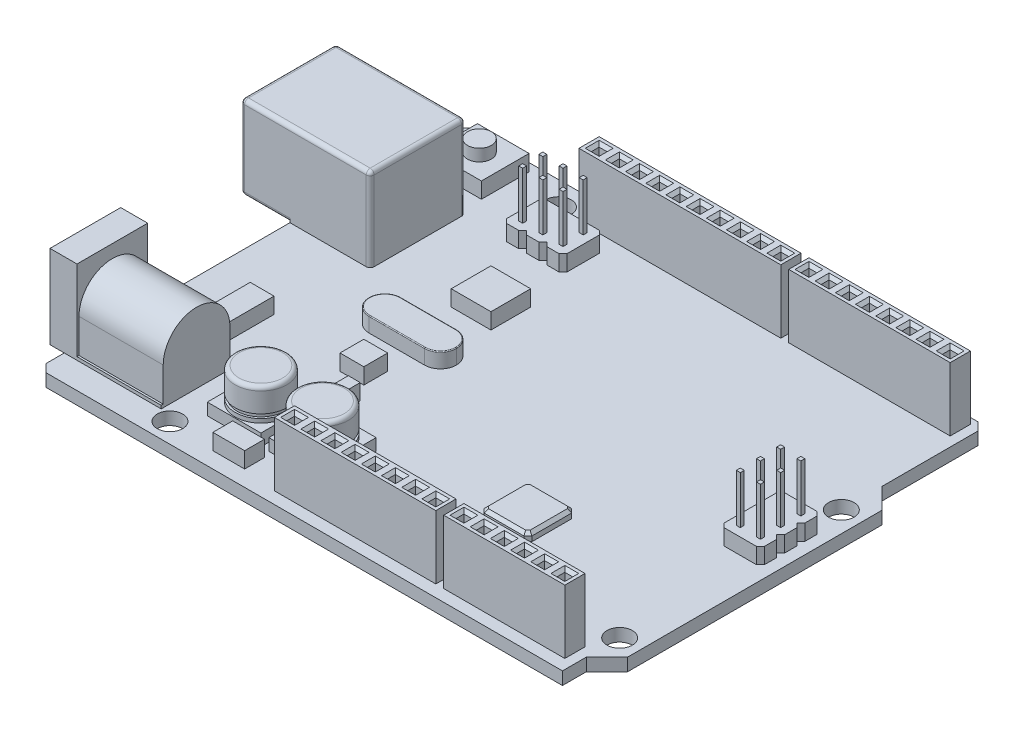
SolidWorks part; units mm, degrees
ref_plane "Front Plane" through (0, 0, 0) normal (0, 0, 1) x (1, 0, 0)
ref_plane "Top Plane" through (0, 0, 0) normal (0, 1, 0) x (1, 0, 0)
ref_plane "Right Plane" through (0, 0, 0) normal (1, 0, 0) x (0, 0, -1)
ref_plane "Decoupe" through (0, 4.1, 0) normal (0, 1, 0) x (-1, 0, 0)
sketch "Sketch1" plane through (0, 0, 0) normal (0, 1, 0) x (1, 0, 0)
  line L0 (35.6, 10.95) -> (35.6, -21.05)
  line L1 (33, -26.65) -> (-32, -26.65)
  line L2 (33, -26.65) -> (33, -23.65)
  line L3 (32, 26.65) -> (-32, 26.65)
  line L4 (-33, -25.65) -> (-33, 25.65)
  line L5 (33, -26.65) -> (-33, 26.65) construction
  line L6 (33, 26.65) -> (-33, -26.65) construction
  line L7 (35.6, -21.05) -> (33, -23.65)
  line L8 (35.6, 10.95) -> (33, 13.55)
  line L9 (33, 13.55) -> (33, 25.65)
  line L10 (-32, -26.65) -> (-33, -25.65)
  line L11 (-33, 25.65) -> (-32, 26.65)
  line L12 (33, 25.65) -> (32, 26.65)
  circle A0 centre (-17.8, 23.65) radius 1.6
  circle A1 centre (-18.9, -24.15) radius 1.6
  circle A2 centre (33, -19.45) radius 1.6
  circle A3 centre (33, 8.45) radius 1.6
  point P0 (0, 0)
  dimension "D7" = 3.2
  dimension "D1" = 66
  dimension "D2" = 53.3
  dimension "D3" = 68.6
  dimension "D4" = 32
  dimension "D5" = 45
  dimension "D6" = 3
  dimension "D8" = 2.5
  dimension "D9" = 27.9
  dimension "D10" = 4.7
  dimension "D11" = 50.8
  dimension "D12" = 51.9
  dimension "D17" = 1.1
  dimension "D18" = 15.2
extrude "Boss-Extrude1" add sketch "Sketch1" along normal blind 1.6
sketch "Sketch2" plane through (0, 1.6, 0) normal (0, 1, 0) x (1, 0, 0)
  line L0 (-33, 25.65) -> (-33, -25.65) construction
  line L1 (-39.2, 17.05) -> (-22.9, 17.05)
  line L2 (-39.2, 17.05) -> (-39.2, 5.05)
  line L3 (-39.2, 5.05) -> (-22.9, 5.05)
  line L4 (-22.9, 17.05) -> (-22.9, 5.05)
  line L5 (32, 26.65) -> (-32, 26.65) construction
  line L6 (-32, -26.65) -> (33, -26.65) construction
  line L7 (-34.8, -14.45) -> (-20.8, -14.45)
  line L8 (-34.8, -14.45) -> (-34.8, -23.35)
  line L9 (-34.8, -23.35) -> (-20.8, -23.35)
  line L10 (-20.8, -14.45) -> (-20.8, -23.35)
  dimension "D1" = 16.3
  dimension "D2" = 12
  dimension "D3" = 6.2
  dimension "D4" = 9.6
  dimension "D5" = 8.9
  dimension "D6" = 14
  dimension "D7" = 1.8
  dimension "D8" = 3.3
extrude "Boss-Extrude2" add sketch "Sketch2" along normal blind 10.5
sketch "Sketch4" plane through (-39.2, 0, 0) normal (-1, 0, 0) x (0, 0, 1)
  line L0 (-11.05, 12.1) -> (-11.05, 1.6) construction
  line L1 (-17.05, 12.1) -> (-5.05, 12.1) construction
  line L2 (-17.05, 1.6) -> (-5.05, 1.6) construction
  line L3 (-6.55, 3.1) -> (-15.55, 3.1)
  line L4 (-15.55, 3.1) -> (-15.55, 8.1)
  line L5 (-15.55, 8.1) -> (-14.35, 10.6)
  line L6 (-14.35, 10.6) -> (-7.75, 10.6)
  line L7 (-7.75, 8.1) -> (-14.35, 8.1)
  line L8 (-14.35, 8.1) -> (-14.35, 5.6)
  line L9 (-14.35, 5.6) -> (-7.75, 5.6)
  line L10 (-7.75, 8.1) -> (-7.75, 5.6)
  line L11 (-6.55, 8.1) -> (-7.75, 10.6)
  line L12 (-6.55, 3.1) -> (-6.55, 8.1)
  point P16 (-11.05, 5.6)
  point P17 (-11.05, 8.1)
  point P18 (-11.05, 10.6)
  point P20 (-11.05, 3.1)
  dimension "D1" = 2.5
  dimension "D2" = 7.5
  dimension "D3" = 9
  dimension "D4" = 1.5
  dimension "D5" = 2.5
  dimension "D6" = 1.2
  dimension "D7" = 1.2
extrude "Cut-Extrude1" cut sketch "Sketch4" against normal blind 10
sketch "Sketch5" plane through (-34.8, 0, 0) normal (-1, 0, 0) x (0, 0, 1)
  line L0 (18.9, 6.85) -> (14.45, 6.85) construction
  line L1 (14.45, 12.1) -> (14.45, 1.6) construction
  line L2 (18.9, 6.85) -> (18.9, 12.1) construction
  line L3 (14.45, 12.1) -> (23.35, 12.1) construction
  circle A0 centre (18.9, 6.85) radius 3.5
  circle A1 centre (18.9, 6.85) radius 0.5
  dimension "D1" = 7
  dimension "D2" = 1
extrude "Cut-Extrude2" cut sketch "Sketch5" against normal blind 10
sketch "Sketch6" plane through (-20.8, 0, 0) normal (1, 0, 0) x (0, 0, -1)
  line L0 (-18.9, 12.1) -> (-18.9, 1.6) construction
  line L1 (-23.35, 12.1) -> (-14.45, 12.1) construction
  line L2 (-23.35, 1.6) -> (-14.45, 1.6) construction
  line L3 (-23.1, 6.267) -> (-23.1, 2)
  line L4 (-23.35, 12.1) -> (-23.35, 1.6) construction
  line L5 (-23.35, 2) -> (-23.35, 12.1)
  line L6 (-23.35, 12.1) -> (-14.45, 12.1)
  line L7 (-14.45, 2) -> (-14.45, 12.1)
  line L8 (-23.65, 1.6) -> (-21.05, 1.6) construction
  line L9 (-23.1, 2) -> (-23.35, 2)
  line L10 (-14.7, 2) -> (-14.45, 2)
  line L11 (-14.7, 6.267) -> (-14.7, 2)
  arc A0 (-14.7, 6.267) -> (-23.1, 6.267) centre (-18.9, 6.267) ccw
  dimension "D2" = 0.4
  dimension "D1" = 0.25
  dimension "D3" = 4.667
extrude "Cut-Extrude3" cut sketch "Sketch6" against normal offset from surface (10.6 mm away) 3.4
sketch "Sketch7" plane through (0, 1.6, 0) normal (0, 1, 0) x (1, 0, 0)
  line L0 (-14.9202, 24.62) -> (31.7998, 24.62) construction
  line L1 (-14.9202, 25.89) -> (10.4798, 25.89)
  line L2 (-14.9202, 25.89) -> (-14.9202, 23.35)
  line L3 (-14.9202, 23.35) -> (10.4798, 23.35)
  line L4 (10.4798, 25.89) -> (10.4798, 23.35)
  line L5 (11.4798, 25.89) -> (31.7998, 25.89)
  line L6 (11.4798, 25.89) -> (11.4798, 23.35)
  line L7 (11.4798, 23.35) -> (31.7998, 23.35)
  line L8 (31.7998, 25.89) -> (31.7998, 23.35)
  line L9 (27.4898, 24.12) -> (28.4898, 24.12)
  line L10 (30.0298, 24.12) -> (31.0298, 24.12)
  line L11 (30.0298, 24.12) -> (30.0298, 25.12)
  line L12 (30.0298, 25.12) -> (31.0298, 25.12)
  line L13 (31.0298, 24.12) -> (31.0298, 25.12)
  line L14 (30.0298, 24.12) -> (31.0298, 25.12) construction
  line L15 (30.0298, 25.12) -> (31.0298, 24.12) construction
  line L16 (27.4898, 24.12) -> (27.4898, 25.12)
  line L17 (27.4898, 25.12) -> (28.4898, 25.12)
  line L18 (28.4898, 24.12) -> (28.4898, 25.12)
  line L19 (27.4898, 24.12) -> (28.4898, 25.12) construction
  line L20 (27.4898, 25.12) -> (28.4898, 24.12) construction
  line L21 (24.9498, 24.12) -> (25.9498, 24.12)
  line L22 (24.9498, 24.12) -> (24.9498, 25.12)
  line L23 (24.9498, 25.12) -> (25.9498, 25.12)
  line L24 (25.9498, 24.12) -> (25.9498, 25.12)
  line L25 (24.9498, 24.12) -> (25.9498, 25.12) construction
  line L26 (24.9498, 25.12) -> (25.9498, 24.12) construction
  line L27 (22.4098, 24.12) -> (23.4098, 24.12)
  line L28 (22.4098, 24.12) -> (22.4098, 25.12)
  line L29 (22.4098, 25.12) -> (23.4098, 25.12)
  line L30 (23.4098, 24.12) -> (23.4098, 25.12)
  line L31 (22.4098, 24.12) -> (23.4098, 25.12) construction
  line L32 (22.4098, 25.12) -> (23.4098, 24.12) construction
  line L33 (19.8698, 24.12) -> (20.8698, 24.12)
  line L34 (19.8698, 24.12) -> (19.8698, 25.12)
  line L35 (19.8698, 25.12) -> (20.8698, 25.12)
  line L36 (20.8698, 24.12) -> (20.8698, 25.12)
  line L37 (19.8698, 24.12) -> (20.8698, 25.12) construction
  line L38 (19.8698, 25.12) -> (20.8698, 24.12) construction
  line L39 (17.3298, 24.12) -> (18.3298, 24.12)
  line L40 (17.3298, 24.12) -> (17.3298, 25.12)
  line L41 (17.3298, 25.12) -> (18.3298, 25.12)
  line L42 (18.3298, 24.12) -> (18.3298, 25.12)
  line L43 (17.3298, 24.12) -> (18.3298, 25.12) construction
  line L44 (17.3298, 25.12) -> (18.3298, 24.12) construction
  line L45 (14.7898, 24.12) -> (15.7898, 24.12)
  line L46 (14.7898, 24.12) -> (14.7898, 25.12)
  line L47 (14.7898, 25.12) -> (15.7898, 25.12)
  line L48 (15.7898, 24.12) -> (15.7898, 25.12)
  line L49 (14.7898, 24.12) -> (15.7898, 25.12) construction
  line L50 (14.7898, 25.12) -> (15.7898, 24.12) construction
  line L51 (12.2498, 24.12) -> (13.2498, 24.12)
  line L52 (12.2498, 24.12) -> (12.2498, 25.12)
  line L53 (12.2498, 25.12) -> (13.2498, 25.12)
  line L54 (13.2498, 24.12) -> (13.2498, 25.12)
  line L55 (12.2498, 24.12) -> (13.2498, 25.12) construction
  line L56 (12.2498, 25.12) -> (13.2498, 24.12) construction
  line L57 (6.1698, 24.12) -> (7.1698, 24.12)
  line L58 (8.7098, 24.12) -> (9.7098, 24.12)
  line L59 (8.7098, 24.12) -> (8.7098, 25.12)
  line L60 (8.7098, 25.12) -> (9.7098, 25.12)
  line L61 (9.7098, 24.12) -> (9.7098, 25.12)
  line L62 (8.7098, 24.12) -> (9.7098, 25.12) construction
  line L63 (8.7098, 25.12) -> (9.7098, 24.12) construction
  line L64 (6.1698, 24.12) -> (6.1698, 25.12)
  line L65 (6.1698, 25.12) -> (7.1698, 25.12)
  line L66 (7.1698, 24.12) -> (7.1698, 25.12)
  line L67 (6.1698, 24.12) -> (7.1698, 25.12) construction
  line L68 (6.1698, 25.12) -> (7.1698, 24.12) construction
  line L69 (3.6298, 24.12) -> (4.6298, 24.12)
  line L70 (3.6298, 24.12) -> (3.6298, 25.12)
  line L71 (3.6298, 25.12) -> (4.6298, 25.12)
  line L72 (4.6298, 24.12) -> (4.6298, 25.12)
  line L73 (-4.7602, -23.88) -> (31.7998, -23.88) construction
  line L74 (31.7998, -25.15) -> (16.5598, -25.15)
  line L75 (31.7998, -25.15) -> (31.7998, -22.61)
  line L76 (31.7998, -22.61) -> (16.5598, -22.61)
  line L77 (16.5598, -25.15) -> (16.5598, -22.61)
  line L78 (15.5598, -22.61) -> (-4.7602, -22.61)
  line L79 (15.5598, -22.61) -> (15.5598, -25.15)
  line L80 (15.5598, -25.15) -> (-4.7602, -25.15)
  line L81 (-4.7602, -22.61) -> (-4.7602, -25.15)
  line L82 (12.2498, -24.38) -> (11.2498, -24.38)
  line L83 (12.2498, -24.38) -> (12.2498, -23.38)
  line L84 (12.2498, -23.38) -> (11.2498, -23.38)
  line L85 (11.2498, -24.38) -> (11.2498, -23.38)
  line L86 (12.2498, -24.38) -> (11.2498, -23.38) construction
  line L87 (12.2498, -23.38) -> (11.2498, -24.38) construction
  line L88 (9.7098, -24.38) -> (8.7098, -24.38)
  line L89 (18.3298, -24.38) -> (17.3298, -24.38)
  line L90 (18.3298, -24.38) -> (18.3298, -23.38)
  line L91 (18.3298, -23.38) -> (17.3298, -23.38)
  line L92 (17.3298, -24.38) -> (17.3298, -23.38)
  line L93 (18.3298, -24.38) -> (17.3298, -23.38) construction
  line L94 (18.3298, -23.38) -> (17.3298, -24.38) construction
  line L95 (9.7098, -24.38) -> (9.7098, -23.38)
  line L96 (9.7098, -23.38) -> (8.7098, -23.38)
  line L97 (8.7098, -24.38) -> (8.7098, -23.38)
  line L98 (9.7098, -24.38) -> (8.7098, -23.38) construction
  line L99 (9.7098, -23.38) -> (8.7098, -24.38) construction
  line L100 (20.8698, -24.38) -> (19.8698, -24.38)
  line L101 (20.8698, -24.38) -> (20.8698, -23.38)
  line L102 (20.8698, -23.38) -> (19.8698, -23.38)
  line L103 (19.8698, -24.38) -> (19.8698, -23.38)
  line L104 (20.8698, -24.38) -> (19.8698, -23.38) construction
  line L105 (20.8698, -23.38) -> (19.8698, -24.38) construction
  line L106 (7.1698, -24.38) -> (6.1698, -24.38)
  line L107 (7.1698, -24.38) -> (7.1698, -23.38)
  line L108 (7.1698, -23.38) -> (6.1698, -23.38)
  line L109 (6.1698, -24.38) -> (6.1698, -23.38)
  line L110 (7.1698, -24.38) -> (6.1698, -23.38) construction
  line L111 (7.1698, -23.38) -> (6.1698, -24.38) construction
  line L112 (23.4098, -24.38) -> (22.4098, -24.38)
  line L113 (23.4098, -24.38) -> (23.4098, -23.38)
  line L114 (23.4098, -23.38) -> (22.4098, -23.38)
  line L115 (22.4098, -24.38) -> (22.4098, -23.38)
  line L116 (23.4098, -24.38) -> (22.4098, -23.38) construction
  line L117 (23.4098, -23.38) -> (22.4098, -24.38) construction
  line L118 (4.6298, -24.38) -> (3.6298, -24.38)
  line L119 (4.6298, -24.38) -> (4.6298, -23.38)
  line L120 (4.6298, -23.38) -> (3.6298, -23.38)
  line L121 (3.6298, -24.38) -> (3.6298, -23.38)
  line L122 (4.6298, -24.38) -> (3.6298, -23.38) construction
  line L123 (4.6298, -23.38) -> (3.6298, -24.38) construction
  line L124 (25.9498, -24.38) -> (24.9498, -24.38)
  line L125 (25.9498, -24.38) -> (25.9498, -23.38)
  line L126 (25.9498, -23.38) -> (24.9498, -23.38)
  line L127 (24.9498, -24.38) -> (24.9498, -23.38)
  line L128 (25.9498, -24.38) -> (24.9498, -23.38) construction
  line L129 (25.9498, -23.38) -> (24.9498, -24.38) construction
  line L130 (2.0898, -24.38) -> (1.0898, -24.38)
  line L131 (2.0898, -24.38) -> (2.0898, -23.38)
  line L132 (2.0898, -23.38) -> (1.0898, -23.38)
  line L133 (1.0898, -24.38) -> (1.0898, -23.38)
  line L134 (2.0898, -24.38) -> (1.0898, -23.38) construction
  line L135 (2.0898, -23.38) -> (1.0898, -24.38) construction
  line L136 (28.4898, -24.38) -> (27.4898, -24.38)
  line L137 (28.4898, -24.38) -> (28.4898, -23.38)
  line L138 (28.4898, -23.38) -> (27.4898, -23.38)
  line L139 (27.4898, -24.38) -> (27.4898, -23.38)
  line L140 (28.4898, -24.38) -> (27.4898, -23.38) construction
  line L141 (28.4898, -23.38) -> (27.4898, -24.38) construction
  line L142 (14.7898, -24.38) -> (13.7898, -24.38)
  line L143 (14.7898, -24.38) -> (14.7898, -23.38)
  line L144 (14.7898, -23.38) -> (13.7898, -23.38)
  line L145 (13.7898, -24.38) -> (13.7898, -23.38)
  line L146 (14.7898, -24.38) -> (13.7898, -23.38) construction
  line L147 (14.7898, -23.38) -> (13.7898, -24.38) construction
  line L148 (31.0298, -24.38) -> (30.0298, -24.38)
  line L149 (31.0298, -24.38) -> (31.0298, -23.38)
  line L150 (31.0298, -23.38) -> (30.0298, -23.38)
  line L151 (30.0298, -24.38) -> (30.0298, -23.38)
  line L152 (31.0298, -24.38) -> (30.0298, -23.38) construction
  line L153 (31.0298, -23.38) -> (30.0298, -24.38) construction
  line L154 (33, -26.65) -> (33, -23.65) construction
  line L155 (-32, -26.65) -> (33, -26.65) construction
  line L156 (3.6298, 24.12) -> (4.6298, 25.12) construction
  line L157 (-0.4502, -24.38) -> (-1.4502, -24.38)
  line L158 (-0.4502, -24.38) -> (-0.4502, -23.38)
  line L159 (-0.4502, -23.38) -> (-1.4502, -23.38)
  line L160 (-1.4502, -24.38) -> (-1.4502, -23.38)
  line L161 (-0.4502, -24.38) -> (-1.4502, -23.38) construction
  line L162 (-0.4502, -23.38) -> (-1.4502, -24.38) construction
  line L163 (-2.9902, -24.38) -> (-3.9902, -24.38)
  line L164 (-2.9902, -24.38) -> (-2.9902, -23.38)
  line L165 (-2.9902, -23.38) -> (-3.9902, -23.38)
  line L166 (-3.9902, -24.38) -> (-3.9902, -23.38)
  line L167 (-2.9902, -24.38) -> (-3.9902, -23.38) construction
  line L168 (-2.9902, -23.38) -> (-3.9902, -24.38) construction
  line L169 (3.6298, 25.12) -> (4.6298, 24.12) construction
  line L170 (1.0898, 24.12) -> (2.0898, 24.12)
  line L171 (1.0898, 24.12) -> (1.0898, 25.12)
  line L172 (1.0898, 25.12) -> (2.0898, 25.12)
  line L173 (2.0898, 24.12) -> (2.0898, 25.12)
  line L174 (1.0898, 24.12) -> (2.0898, 25.12) construction
  line L175 (1.0898, 25.12) -> (2.0898, 24.12) construction
  line L176 (-1.4502, 24.12) -> (-0.4502, 24.12)
  line L177 (-1.4502, 24.12) -> (-1.4502, 25.12)
  line L178 (-1.4502, 25.12) -> (-0.4502, 25.12)
  line L179 (-0.4502, 24.12) -> (-0.4502, 25.12)
  line L180 (-1.4502, 24.12) -> (-0.4502, 25.12) construction
  line L181 (-1.4502, 25.12) -> (-0.4502, 24.12) construction
  line L182 (-3.9902, 24.12) -> (-2.9902, 24.12)
  line L183 (-3.9902, 24.12) -> (-3.9902, 25.12)
  line L184 (-3.9902, 25.12) -> (-2.9902, 25.12)
  line L185 (-2.9902, 24.12) -> (-2.9902, 25.12)
  line L186 (-3.9902, 24.12) -> (-2.9902, 25.12) construction
  line L187 (-3.9902, 25.12) -> (-2.9902, 24.12) construction
  line L188 (-6.5302, 24.12) -> (-5.5302, 24.12)
  line L189 (-6.5302, 24.12) -> (-6.5302, 25.12)
  line L190 (-6.5302, 25.12) -> (-5.5302, 25.12)
  line L191 (-5.5302, 24.12) -> (-5.5302, 25.12)
  line L192 (-6.5302, 24.12) -> (-5.5302, 25.12) construction
  line L193 (-6.5302, 25.12) -> (-5.5302, 24.12) construction
  line L194 (-9.0702, 24.12) -> (-8.0702, 24.12)
  line L195 (-9.0702, 24.12) -> (-9.0702, 25.12)
  line L196 (-9.0702, 25.12) -> (-8.0702, 25.12)
  line L197 (-8.0702, 24.12) -> (-8.0702, 25.12)
  line L198 (-9.0702, 24.12) -> (-8.0702, 25.12) construction
  line L199 (-9.0702, 25.12) -> (-8.0702, 24.12) construction
  line L200 (-11.6102, 24.12) -> (-10.6102, 24.12)
  line L201 (-11.6102, 24.12) -> (-11.6102, 25.12)
  line L202 (-11.6102, 25.12) -> (-10.6102, 25.12)
  line L203 (-10.6102, 24.12) -> (-10.6102, 25.12)
  line L204 (-11.6102, 24.12) -> (-10.6102, 25.12) construction
  line L205 (-11.6102, 25.12) -> (-10.6102, 24.12) construction
  line L206 (-14.1502, 24.12) -> (-13.1502, 24.12)
  line L207 (-14.1502, 24.12) -> (-14.1502, 25.12)
  line L208 (-14.1502, 25.12) -> (-13.1502, 25.12)
  line L209 (-13.1502, 24.12) -> (-13.1502, 25.12)
  line L210 (-14.1502, 24.12) -> (-13.1502, 25.12) construction
  line L211 (-14.1502, 25.12) -> (-13.1502, 24.12) construction
  point P8 (30.5298, 24.62)
  point P13 (9.2098, 24.62)
  point P14 (27.9898, 24.62)
  point P23 (25.4498, 24.62)
  point P28 (22.9098, 24.62)
  point P33 (20.3698, 24.62)
  point P38 (17.8298, 24.62)
  point P43 (15.2898, 24.62)
  point P48 (12.7498, 24.62)
  point P59 (6.6698, 24.62)
  point P64 (4.1298, 24.62)
  point P69 (1.5898, 24.62)
  point P74 (-0.9502, 24.62)
  point P86 (11.7498, -23.88)
  point P87 (9.2098, -23.88)
  point P88 (6.6698, -23.88)
  point P89 (4.1298, -23.88)
  point P90 (17.8298, -23.88)
  point P97 (11.7498, -23.88)
  point P102 (20.3698, -23.88)
  point P107 (9.2098, -23.88)
  point P112 (22.9098, -23.88)
  point P117 (6.6698, -23.88)
  point P122 (25.4498, -23.88)
  point P127 (4.1298, -23.88)
  point P132 (27.9898, -23.88)
  point P137 (14.2898, -23.88)
  point P142 (30.5298, -23.88)
  point P149 (1.5898, -23.88)
  point P151 (-3.4902, 24.62)
  point P156 (-0.9502, -23.88)
  point P161 (-3.4902, -23.88)
  point P170 (-6.0302, 24.62)
  point P175 (-8.5702, 24.62)
  point P180 (-11.1102, 24.62)
  point P185 (-13.6502, 24.62)
  dimension "D3" = 1.27
  dimension "D4" = 1
  dimension "D5" = 8
  dimension "D6" = 1.27
  dimension "D7" = 2.54
  dimension "D8" = 1.27
  dimension "D10" = 1.27
  dimension "D11" = 48.5
  dimension "D12" = 1
  dimension "D13" = 1
  dimension "D14" = 8
  dimension "D15" = 1.27
  dimension "D16" = 2.54
  dimension "D17" = 2.54
  dimension "D18" = 1.5
  dimension "D20" = 1.2002
  dimension "D21" = 2.54
  dimension "D22" = 1.27
  dimension "D23" = 1.27
  dimension "D24" = 2.54
  dimension "D19" = 6
  dimension "D9" = 10
extrude "Boss-Extrude3" add sketch "Sketch7" along normal blind 8
sketch "Sketch8" plane through (0, 1.6, 0) normal (0, 1, 0) x (1, 0, 0)
  line L1 (-2.65, -21.2) -> (-9.4, -21.2)
  line L2 (-2.65, -21.2) -> (-2.65, -14.45)
  line L3 (-2.65, -14.45) -> (-9.4, -14.45)
  line L4 (-9.4, -21.2) -> (-9.4, -14.45)
  line L5 (-2.65, -21.2) -> (-9.4, -14.45) construction
  line L6 (-2.65, -14.45) -> (-9.4, -21.2) construction
  line L7 (-10.4, -21.2) -> (-17.15, -21.2)
  line L8 (-10.4, -21.2) -> (-10.4, -14.45)
  line L9 (-10.4, -14.45) -> (-17.15, -14.45)
  line L10 (-17.15, -21.2) -> (-17.15, -14.45)
  line L11 (-10.4, -21.2) -> (-17.15, -14.45) construction
  line L12 (-10.4, -14.45) -> (-17.15, -21.2) construction
  line L15 (-20.8, -14.45) -> (-33, -14.45) construction
  circle A0 centre (-18.9, -24.15) radius 1.6 construction
  point P0 (-6.025, -17.825)
  point P5 (-13.775, -17.825)
  dimension "D1" = 6.75
  dimension "D2" = 1
  dimension "D3" = 1.75
extrude "Boss-Extrude4" add sketch "Sketch8" along normal blind 1.5
sketch "Sketch9" plane through (0, 3.1, 0) normal (0, 1, 0) x (1, 0, 0)
  line L0 (-13.775, -14.45) -> (-13.775, -17.825) construction
  line L1 (-10.4, -14.45) -> (-17.15, -14.45) construction
  line L2 (-17.15, -17.825) -> (-13.775, -17.825) construction
  line L3 (-17.15, -14.45) -> (-17.15, -21.2) construction
  line L4 (-6.025, -14.45) -> (-6.025, -17.825) construction
  line L5 (-2.65, -14.45) -> (-9.4, -14.45) construction
  circle A0 centre (-6.025, -17.825) radius 3.25
  circle A1 centre (-13.775, -17.825) radius 3.25
  dimension "D1" = 6.5
extrude "Boss-Extrude5" add sketch "Sketch9" along normal blind 4
sketch "Sketch11" plane through (0, 1.6, 0) normal (0, 1, 0) x (1, 0, 0)
  line L0 (-17.31, 21.69) -> (-17.81, 21.19)
  line L1 (-15.77, 16.61) -> (-17.31, 16.61)
  line L2 (32, 26.65) -> (-32, 26.65) construction
  line L3 (-15.77, 21.69) -> (-17.31, 21.69)
  line L4 (-17.81, 17.11) -> (-17.81, 21.19)
  line L5 (-17.81, 19.15) -> (-10.19, 19.15) construction
  line L6 (-14, 21.69) -> (-14, 16.61) construction
  line L7 (-15.27, 21.19) -> (-15.77, 21.69)
  line L8 (-15.77, 16.61) -> (-15.27, 17.11)
  line L9 (-17.31, 16.61) -> (-17.81, 17.11)
  line L10 (-14.77, 21.69) -> (-15.27, 21.19)
  line L11 (-13.23, 16.61) -> (-14.77, 16.61)
  line L12 (-33, 25.65) -> (-33, 17.05) construction
  line L13 (-13.23, 21.69) -> (-14.77, 21.69)
  line L14 (29.56, 4.75) -> (29.06, 4.25)
  line L17 (-12.73, 21.19) -> (-13.23, 21.69)
  line L18 (-13.23, 16.61) -> (-12.73, 17.11)
  line L19 (-14.77, 16.61) -> (-15.27, 17.11)
  line L20 (-12.23, 21.69) -> (-12.73, 21.19)
  line L21 (-10.69, 16.61) -> (-12.23, 16.61)
  line L22 (-10.19, 17.11) -> (-10.19, 21.19)
  line L23 (-10.69, 21.69) -> (-12.23, 21.69)
  line L24 (29.56, 2.21) -> (33.64, 2.21) construction
  line L27 (-10.19, 21.19) -> (-10.69, 21.69)
  line L28 (-10.69, 16.61) -> (-10.19, 17.11)
  line L29 (-12.23, 16.61) -> (-12.73, 17.11)
  line L30 (11.4798, 23.35) -> (31.7998, 23.35) construction
  line L31 (34.14, 2.71) -> (34.14, 4.25)
  line L32 (33.64, 4.75) -> (29.56, 4.75)
  line L33 (29.06, 2.71) -> (29.06, 4.25)
  line L34 (31.6, 4.75) -> (31.6, -2.87) construction
  line L35 (35.6, -21.05) -> (35.6, 10.95) construction
  line L36 (29.56, 2.21) -> (29.06, 2.71)
  line L37 (34.14, 2.71) -> (33.64, 2.21)
  line L38 (34.14, 4.25) -> (33.64, 4.75)
  line L39 (29.56, 2.21) -> (29.06, 1.71)
  line L40 (29.56, -0.33) -> (33.64, -0.33) construction
  line L41 (34.14, 0.17) -> (34.14, 1.71)
  line L42 (-15.27, 21.19) -> (-15.27, 17.11) construction
  line L43 (29.06, 0.17) -> (29.06, 1.71)
  line L44 (-12.73, 21.19) -> (-12.73, 17.11) construction
  line L45 (-17.81, 21.19) -> (-10.19, 21.19) construction
  line L46 (29.56, -0.33) -> (29.06, 0.17)
  line L47 (34.14, 0.17) -> (33.64, -0.33)
  line L48 (34.14, 1.71) -> (33.64, 2.21)
  line L49 (29.56, -0.33) -> (29.06, -0.83)
  line L50 (33.64, -2.87) -> (29.56, -2.87)
  line L51 (34.14, -2.37) -> (34.14, -0.83)
  line L52 (-10.19, 17.11) -> (-17.81, 17.11) construction
  line L53 (29.06, -2.37) -> (29.06, -0.83)
  line L56 (29.56, -2.87) -> (29.06, -2.37)
  line L57 (34.14, -2.37) -> (33.64, -2.87)
  line L58 (34.14, -0.83) -> (33.64, -0.33)
  point P13 (-14, 19.15)
  dimension "D3" = 0.5
  dimension "D29" = 7.62
  dimension "D2" = 5.08
  dimension "D8" = 7.62
  dimension "D14" = 4
  dimension "D16" = 5.08
  dimension "D22" = 2.54
  dimension "D23" = 7.5
  dimension "D24" = 19
  dimension "D25" = 2.54
  dimension "D26" = 0.5
  dimension "D27" = 0.5
  dimension "D28" = 18.6
  dimension "D4" = 0.5
extrude "Boss-Extrude7" add sketch "Sketch11" along normal blind 2
sketch "Sketch12" plane through (0, 3.6, 0) normal (0, 1, 0) x (1, 0, 0)
  line L0 (-16.54, 21.69) -> (-16.54, 16.61) construction
  line L1 (-16.29, 20.17) -> (-16.79, 20.17)
  line L2 (-16.29, 20.17) -> (-16.29, 20.67)
  line L3 (-16.29, 20.67) -> (-16.79, 20.67)
  line L4 (-16.79, 20.17) -> (-16.79, 20.67)
  line L5 (-16.29, 20.17) -> (-16.79, 20.67) construction
  line L6 (-16.29, 20.67) -> (-16.79, 20.17) construction
  line L7 (-16.29, 17.63) -> (-16.79, 18.13) construction
  line L8 (-16.29, 18.13) -> (-16.79, 17.63) construction
  line L9 (-16.79, 18.13) -> (-16.79, 17.63)
  line L10 (-16.29, 17.63) -> (-16.79, 17.63)
  line L11 (-16.29, 18.13) -> (-16.29, 17.63)
  line L12 (-16.29, 18.13) -> (-16.79, 18.13)
  line L13 (-15.77, 21.69) -> (-17.31, 21.69) construction
  line L14 (-17.31, 16.61) -> (-15.77, 16.61) construction
  line L15 (-17.81, 19.15) -> (-10.19, 19.15) construction
  line L16 (-17.81, 21.19) -> (-17.81, 17.11) construction
  line L17 (-10.19, 17.11) -> (-10.19, 21.19) construction
  line L18 (-13.75, 20.17) -> (-14.25, 20.17)
  line L19 (-13.75, 20.17) -> (-13.75, 20.67)
  line L20 (-13.75, 20.67) -> (-14.25, 20.67)
  line L21 (-14.25, 20.17) -> (-14.25, 20.67)
  line L22 (-14.25, 18.13) -> (-14.25, 17.63)
  line L23 (-13.75, 17.63) -> (-14.25, 17.63)
  line L24 (-13.75, 18.13) -> (-13.75, 17.63)
  line L25 (-13.75, 18.13) -> (-14.25, 18.13)
  line L26 (-13.75, 20.17) -> (-14.25, 20.67) construction
  line L27 (-13.75, 20.67) -> (-14.25, 20.17) construction
  line L28 (-13.75, 17.63) -> (-14.25, 18.13) construction
  line L29 (-13.75, 18.13) -> (-14.25, 17.63) construction
  line L30 (-11.21, 20.17) -> (-11.71, 20.17)
  line L31 (-11.21, 20.17) -> (-11.21, 20.67)
  line L32 (-11.21, 20.67) -> (-11.71, 20.67)
  line L33 (-11.71, 20.17) -> (-11.71, 20.67)
  line L34 (-11.71, 18.13) -> (-11.71, 17.63)
  line L35 (-11.21, 17.63) -> (-11.71, 17.63)
  line L36 (-11.21, 18.13) -> (-11.21, 17.63)
  line L37 (-11.21, 18.13) -> (-11.71, 18.13)
  line L38 (-11.21, 20.17) -> (-11.71, 20.67) construction
  line L39 (-11.21, 20.67) -> (-11.71, 20.17) construction
  line L40 (-11.21, 17.63) -> (-11.71, 18.13) construction
  line L41 (-11.21, 18.13) -> (-11.71, 17.63) construction
  line L42 (31.6, 4.75) -> (31.6, -2.87) construction
  line L43 (33.64, 4.75) -> (29.56, 4.75) construction
  line L44 (29.56, -2.87) -> (33.64, -2.87) construction
  line L45 (34.14, 3.48) -> (29.06, 3.48) construction
  line L46 (34.14, 2.71) -> (34.14, 4.25) construction
  line L47 (29.06, 4.25) -> (29.06, 2.71) construction
  line L48 (30.08, 3.73) -> (30.58, 3.23) construction
  line L49 (33.12, 3.23) -> (32.62, 3.23)
  line L50 (33.12, 3.23) -> (33.12, 3.73)
  line L51 (33.12, 3.73) -> (32.62, 3.73)
  line L52 (32.62, 3.23) -> (32.62, 3.73)
  line L53 (33.12, 3.23) -> (32.62, 3.73) construction
  line L54 (33.12, 3.73) -> (32.62, 3.23) construction
  line L55 (30.08, 3.23) -> (30.58, 3.73) construction
  line L56 (30.58, 3.23) -> (30.58, 3.73)
  line L57 (30.08, 3.73) -> (30.58, 3.73)
  line L58 (30.08, 3.23) -> (30.08, 3.73)
  line L59 (30.08, 3.23) -> (30.58, 3.23)
  line L60 (33.12, 0.69) -> (32.62, 0.69)
  line L61 (33.12, 0.69) -> (33.12, 1.19)
  line L62 (33.12, 1.19) -> (32.62, 1.19)
  line L63 (32.62, 0.69) -> (32.62, 1.19)
  line L64 (30.58, 0.69) -> (30.58, 1.19)
  line L65 (30.08, 1.19) -> (30.58, 1.19)
  line L66 (30.08, 0.69) -> (30.08, 1.19)
  line L67 (30.08, 0.69) -> (30.58, 0.69)
  line L68 (30.08, 1.19) -> (30.58, 0.69) construction
  line L69 (33.12, 0.69) -> (32.62, 1.19) construction
  line L70 (33.12, 1.19) -> (32.62, 0.69) construction
  line L71 (30.08, 0.69) -> (30.58, 1.19) construction
  line L72 (33.12, -1.85) -> (32.62, -1.85)
  line L73 (33.12, -1.85) -> (33.12, -1.35)
  line L74 (33.12, -1.35) -> (32.62, -1.35)
  line L75 (32.62, -1.85) -> (32.62, -1.35)
  line L76 (30.58, -1.85) -> (30.58, -1.35)
  line L77 (30.08, -1.35) -> (30.58, -1.35)
  line L78 (30.08, -1.85) -> (30.08, -1.35)
  line L79 (30.08, -1.85) -> (30.58, -1.85)
  line L80 (30.08, -1.35) -> (30.58, -1.85) construction
  line L81 (33.12, -1.85) -> (32.62, -1.35) construction
  line L82 (33.12, -1.35) -> (32.62, -1.85) construction
  line L83 (30.08, -1.85) -> (30.58, -1.35) construction
  line L84 (30.33, 3.48) -> (30.33, -1.6) construction
  line L85 (-16.54, 17.88) -> (-11.46, 17.88) construction
  point P0 (-16.54, 20.42)
  point P9 (-16.54, 17.88)
  point P23 (-14, 20.42)
  point P32 (-14, 17.88)
  point P33 (-11.46, 20.42)
  point P42 (-11.46, 17.88)
  point P54 (32.87, 3.48)
  point P63 (30.33, 3.48)
  point P65 (32.87, 0.94)
  point P74 (30.33, 0.94)
  point P75 (32.87, -1.6)
  point P84 (30.33, -1.6)
  dimension "D1" = 0.5
  dimension "D2" = 2.54
  dimension "D4" = 0.5
  dimension "D5" = 2.54
  dimension "D7" = 2.54
  dimension "D8" = 2.54
  dimension "D3" = 3
  dimension "D6" = 3
extrude "Boss-Extrude8" add sketch "Sketch12" along normal up to surface (6 mm away)
sketch "Sketch13" plane through (0, 1.6, 0) normal (0, 1, 0) x (1, 0, 0)
  line L0 (17, -9.5) -> (16.5, -9)
  line L1 (16.5, -15) -> (11.5, -15)
  line L2 (17, -14.5) -> (17, -9.5)
  line L3 (16.5, -9) -> (11.5, -9)
  line L4 (11, -14.5) -> (11, -9.5)
  line L5 (17, -15) -> (11, -9) construction
  line L6 (17, -9) -> (11, -15) construction
  line L7 (16.5, -15) -> (17, -14.5)
  line L8 (11.5, -15) -> (11, -14.5)
  line L9 (11, -9.5) -> (11.5, -9)
  line L10 (11.5, -9) -> (11, -9) construction
  line L11 (11, -9) -> (11, -9.5) construction
  line L12 (17, -9.5) -> (17, -9) construction
  line L13 (16.5, -9) -> (17, -9) construction
  line L14 (16.5, -15) -> (17, -15) construction
  line L15 (17, -15) -> (17, -14.5) construction
  line L16 (11.5, -15) -> (11, -15) construction
  line L17 (11, -15) -> (11, -14.5) construction
  point P0 (14, -12)
  dimension "D1" = 6
  dimension "D2" = 12
  dimension "D3" = 14
  dimension "D4" = 6
extrude "Boss-Extrude9" add sketch "Sketch13" along normal blind 1
sketch "Esquisse1" plane through (0, 0, 0) normal (0, 1, 0) x (1, 0, 0)
  line L0 (0, 0) -> (-12.5, 0) construction
  line L1 (-18, 2) -> (-7, 2)
  line L2 (-18, 2) -> (-18, -2)
  line L3 (-18, -2) -> (-7, -2)
  line L4 (-7, 2) -> (-7, -2)
  line L5 (-18, 2) -> (-7, -2) construction
  line L6 (-18, -2) -> (-7, 2) construction
  line L7 (-33, 5.05) -> (-33, -14.45) construction
  point P0 (-12.5, 0)
  dimension "D1" = 4
  dimension "D2" = 15
  dimension "D3" = 11
extrude "Boss.-Extrude10" add sketch "Esquisse1" along normal blind 3.5
sketch "Esquisse3" plane through (0, 4.1, 0) normal (0, 1, 0) x (-1, 0, 0)
  circle A0 centre (6.025, 17.825) radius 3.25
  circle A1 centre (6.025, 17.825) radius 3
  circle A2 centre (6.025, 17.825) radius 3.25 construction
  circle A3 centre (13.775, 17.825) radius 3
  circle A4 centre (13.775, 17.825) radius 3.25
  circle A5 centre (13.775, 17.825) radius 3.25 construction
  dimension "D1" = 6.5
  dimension "D2" = 6
extrude "Enlèv. mat.-Extru.1" cut sketch "Esquisse3" against normal blind 0.5
sketch "Esquisse4" plane through (0, 0, 0) normal (0, 1, 0) x (1, 0, 0)
  line L0 (-33, 25.65) -> (-33, 17.05) construction
  line L1 (-30, 25.65) -> (-23.5, 25.65)
  line L2 (-30, 25.65) -> (-30, 19.65)
  line L3 (-30, 19.65) -> (-23.5, 19.65)
  line L4 (-23.5, 25.65) -> (-23.5, 19.65)
  line L5 (32, 26.65) -> (-32, 26.65) construction
  dimension "D1" = 6
  dimension "D2" = 6.5
  dimension "D3" = 3
  dimension "D4" = 1
extrude "Boss.-Extru.1" add sketch "Esquisse4" along normal blind 3.6
sketch "Esquisse5" plane through (0, 0, 0) normal (0, 1, 0) x (1, 0, 0)
  line L0 (-23.5, 25.65) -> (-30, 19.65) construction
  circle A0 centre (-26.75, 22.65) radius 1.5
  dimension "D1" = 3
extrude "Boss.-Extru.2" add sketch "Esquisse5" along normal blind 5.1
sketch "Esquisse6" plane through (0, 0, 0) normal (0, 1, 0) x (1, 0, 0)
  line L0 (-32, -26.65) -> (33, -26.65) construction
  line L1 (-13.65, 11) -> (-8.65, 11)
  line L2 (-13.65, 11) -> (-13.65, 6)
  line L3 (-13.65, 6) -> (-8.65, 6)
  line L4 (-8.65, 11) -> (-8.65, 6)
  line L5 (-13.65, -5) -> (-10.65, -5)
  line L6 (-13.65, -5) -> (-13.65, -8)
  line L7 (-13.65, -8) -> (-10.65, -8)
  line L8 (-10.65, -5) -> (-10.65, -8)
  line L9 (-27, -5.95) -> (-24, -5.95)
  line L10 (-27, -5.95) -> (-27, -12.45)
  line L11 (-27, -12.45) -> (-24, -12.45)
  line L12 (-24, -5.95) -> (-24, -12.45)
  line L13 (-10.65, -9.95) -> (-9.15, -9.95)
  line L14 (-10.65, -9.95) -> (-10.65, -12.45)
  line L15 (-10.65, -12.45) -> (-9.15, -12.45)
  line L16 (-9.15, -9.95) -> (-9.15, -12.45)
  line L17 (-13, -22.15) -> (-9, -22.15)
  line L18 (-13, -22.15) -> (-13, -24.65)
  line L19 (-13, -24.65) -> (-9, -24.65)
  line L20 (-9, -22.15) -> (-9, -24.65)
  line L21 (-33, -23.35) -> (-33, -25.65) construction
  line L22 (-2.65, -14.45) -> (-9.4, -14.45) construction
  line L23 (-10.4, -21.2) -> (-10.4, -14.45) construction
  line L24 (-9.4, -14.45) -> (-9.4, -21.2) construction
  line L25 (-33, 5.05) -> (-33, -14.45) construction
  line L26 (-20.8, -14.45) -> (-33, -14.45) construction
  line L28 (-7, -2) -> (-18, -2) construction
  line L29 (-18, 2) -> (-7, 2) construction
  dimension "D1" = 4
  dimension "D2" = 2.5
  dimension "D3" = 2
  dimension "D4" = 20
  dimension "D5" = 1.5
  dimension "D6" = 2.5
  dimension "D7" = 2
  dimension "D8" = 0.25
  dimension "D9" = 0.25
  dimension "D10" = 6
  dimension "D11" = 3
  dimension "D12" = 6.5
  dimension "D13" = 2
  dimension "D14" = 3
  dimension "D15" = 3
  dimension "D16" = 5
  dimension "D17" = 4
extrude "Boss.-Extru.3" add sketch "Esquisse6" along normal blind 3.6
chamfer "Chamfer1" distance 0.375 angle 45 128 edges at (12.7498, 9.6, -24.12) (13.2498, 9.6, -24.62) (12.7498, 9.6, -25.12) (12.2498, 9.6, -24.62) (20.3698, 9.6, -25.12) (25.4498, 9.6, -24.12) (1.5898, 9.6, -25.12) (6.6698, 9.6, -24.12) (9.2098, 9.6, -24.12) (9.7098, 9.6, -24.62) (9.2098, 9.6, -25.12) (8.7098, 9.6, -24.62) (14.2898, 9.6, 24.38) (14.7898, 9.6, 23.88) (14.2898, 9.6, 23.38) (13.7898, 9.6, 23.88) (31.0298, 9.6, 23.88) (30.5298, 9.6, 23.38) (30.0298, 9.6, 23.88) (30.5298, 9.6, 24.38) (28.4898, 9.6, 23.88) (27.9898, 9.6, 23.38) (27.4898, 9.6, 23.88) (27.9898, 9.6, 24.38) (25.9498, 9.6, 23.88) (25.4498, 9.6, 23.38) (24.9498, 9.6, 23.88) (25.4498, 9.6, 24.38) (23.4098, 9.6, 23.88) (22.9098, 9.6, 23.38) (22.4098, 9.6, 23.88) (22.9098, 9.6, 24.38) (20.8698, 9.6, 23.88) (20.3698, 9.6, 23.38) (19.8698, 9.6, 23.88) (20.3698, 9.6, 24.38) (18.3298, 9.6, 23.88) (17.8298, 9.6, 23.38) (17.3298, 9.6, 23.88) (17.8298, 9.6, 24.38) (-2.9902, 9.6, 23.88) (-3.4902, 9.6, 23.38) (-3.9902, 9.6, 23.88) (-3.4902, 9.6, 24.38) (-0.9502, 9.6, 24.38) (-0.4502, 9.6, 23.88) (-1.4502, 9.6, 23.88) (-0.9502, 9.6, 23.38) (1.0898, 9.6, 23.88) (1.5898, 9.6, 23.38) (2.0898, 9.6, 23.88) (1.5898, 9.6, 24.38) (4.1298, 9.6, 24.38) (3.6298, 9.6, 23.88) (4.1298, 9.6, 23.38) (4.6298, 9.6, 23.88) (6.1698, 9.6, 23.88) (6.6698, 9.6, 23.38) (7.1698, 9.6, 23.88) (6.6698, 9.6, 24.38) (9.2098, 9.6, 24.38) (8.7098, 9.6, 23.88) (9.2098, 9.6, 23.38) (9.7098, 9.6, 23.88) (11.2498, 9.6, 23.88) (11.7498, 9.6, 24.38) (12.2498, 9.6, 23.88) (11.7498, 9.6, 23.38) (19.8698, 9.6, -24.62) (20.3698, 9.6, -24.12) (20.8698, 9.6, -24.62) (24.9498, 9.6, -24.62) (25.9498, 9.6, -24.62) (25.4498, 9.6, -25.12) (1.0898, 9.6, -24.62) (1.5898, 9.6, -24.12) (2.0898, 9.6, -24.62) (6.1698, 9.6, -24.62) (7.1698, 9.6, -24.62) (6.6698, 9.6, -25.12) (-14.1502, 9.6, -24.62) (-13.6502, 9.6, -24.12) (-13.1502, 9.6, -24.62) (-13.6502, 9.6, -25.12) (-11.6102, 9.6, -24.62) (-11.1102, 9.6, -24.12) (-10.6102, 9.6, -24.62) (-11.1102, 9.6, -25.12) (-9.0702, 9.6, -24.62) (-8.5702, 9.6, -24.12) (-8.0702, 9.6, -24.62) (-8.5702, 9.6, -25.12) (-6.5302, 9.6, -24.62) (-6.0302, 9.6, -24.12) (-5.5302, 9.6, -24.62) (-6.0302, 9.6, -25.12) (-3.9902, 9.6, -24.62) (-3.4902, 9.6, -24.12) (-2.9902, 9.6, -24.62) (-3.4902, 9.6, -25.12) (-1.4502, 9.6, -24.62) (-0.9502, 9.6, -24.12) (-0.4502, 9.6, -24.62) (-0.9502, 9.6, -25.12) (3.6298, 9.6, -24.62) (4.1298, 9.6, -24.12) (4.6298, 9.6, -24.62) (4.1298, 9.6, -25.12) (14.7898, 9.6, -24.62) (15.2898, 9.6, -24.12) (15.7898, 9.6, -24.62) (15.2898, 9.6, -25.12) (17.3298, 9.6, -24.62) (17.8298, 9.6, -24.12) (18.3298, 9.6, -24.62) (17.8298, 9.6, -25.12) (22.4098, 9.6, -24.62) (22.9098, 9.6, -24.12) (23.4098, 9.6, -24.62) (22.9098, 9.6, -25.12) (27.4898, 9.6, -24.62) (27.9898, 9.6, -24.12) (28.4898, 9.6, -24.62) (27.9898, 9.6, -25.12) (30.0298, 9.6, -24.62) (30.5298, 9.6, -24.12) (31.0298, 9.6, -24.62) (30.5298, 9.6, -25.12)
chamfer "Chamfer2" distance 0.375 angle 45 8 edges at (16.75, 2.6, 9.25) (17, 2.6, 12) (16.75, 2.6, 14.75) (14, 2.6, 15) (11.25, 2.6, 14.75) (11, 2.6, 12) (11.25, 2.6, 9.25) (14, 2.6, 9)
fillet "Fillet1" radius 0.5 11 edges at (-39.2, 12.1, -11.05) (-39.2, 1.6, -11.05) (-36.1, 1.6, -17.05) (-36.1, 1.6, -5.05) (-39.2, 6.85, -17.05) (-39.2, 6.85, -5.05) (-22.9, 6.85, -17.05) (-22.9, 6.85, -5.05) (-22.9, 12.1, -11.05) (-31.05, 12.1, -17.05) (-31.05, 12.1, -5.05)
fillet "Fillet2" radius 0.5 1 edges at (-34.8, 6.85, 19.4)
fillet "Congé1" radius 2 4 edges at (-7, 2.55, -2) (-18, 2.55, -2) (-18, 2.55, 2) (-7, 2.55, 2)
fillet "Congé2" radius 0.1 6 edges at (-17.4142, 3.5, 1.4142) (-17.4142, 3.5, -1.4142) (-12.5, 3.5, -2) (-7.5858, 3.5, -1.4142) (-7.5858, 3.5, 1.4142) (-12.5, 3.5, 2)
fillet "Congé3" radius 0.5 2 edges at (-6.025, 7.1, 21.075) (-13.775, 7.1, 21.075)
